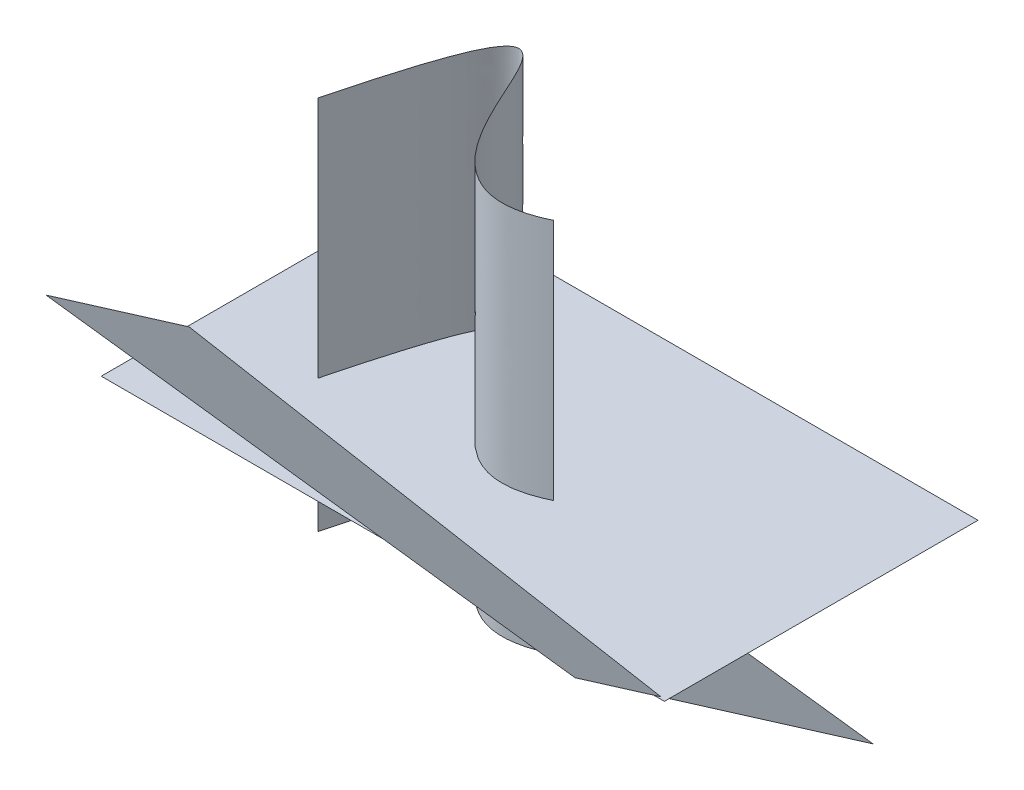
SolidWorks part; units mm, degrees
ref_plane "Front Plane" through (0, 0, 0) normal (0, 0, 1) x (1, 0, 0)
ref_plane "Top Plane" through (0, 0, 0) normal (0, 1, 0) x (1, 0, 0)
ref_plane "Right Plane" through (0, 0, 0) normal (1, 0, 0) x (0, 0, -1)
sketch "Sketch1" plane through (0, 0, 0) normal (0, 1, 0) x (1, 0, 0)
  line L0 (-76.0637, -8.1497) -> (0, 81.4969)
  line L1 (0, 81.4969) -> (145.258, -41.7524)
  line L2 (145.258, -41.7524) -> (-76.0637, -8.1497)
surface "Surface-Plane1" sketch "Sketch1"
ref_plane "Plane1" through (0, 96.52, 0) normal (0, 1, 0) x (1, 0, 0)
sketch "Sketch2" plane through (0, 96.52, 0) normal (0, 1, 0) x (1, 0, 0)
  spline S0 degree 3 poles (-33.5743, 0) (2.5244, 140.6176) (-10.6067, -27.6706) (55.3213, 4.6018) knots 0 0 0 0 1 1 1 1
ref_plane "Plane2" through (-0.9618, -9.1503, 6.3345) normal (0.0861, 0.8192, -0.5671) x (0.9887, 0, 0.1501)
sketch "Sketch3" plane through (-0.9618, -9.1503, 6.3345) normal (0.0861, 0.8192, -0.5671) x (0.9887, 0, 0.1501)
  line L0 (-79.2261, 19.2586) -> (26.7272, 72.2353)
  line L1 (26.7272, 72.2353) -> (146.1655, 6.4158)
  line L2 (146.1655, 6.4158) -> (101.2156, -39.8184)
  line L3 (101.2156, -39.8184) -> (-62.2094, -84.1261)
  line L4 (-62.2094, -84.1261) -> (-79.2261, 19.2586)
surface "Surface-Plane2" sketch "Sketch3"
surface "Surface-Extrude1" sketch "Sketch2"
surface "Surface-Untrim1"
surface "Surface-Untrim2"
surface "Surface-Untrim3"
